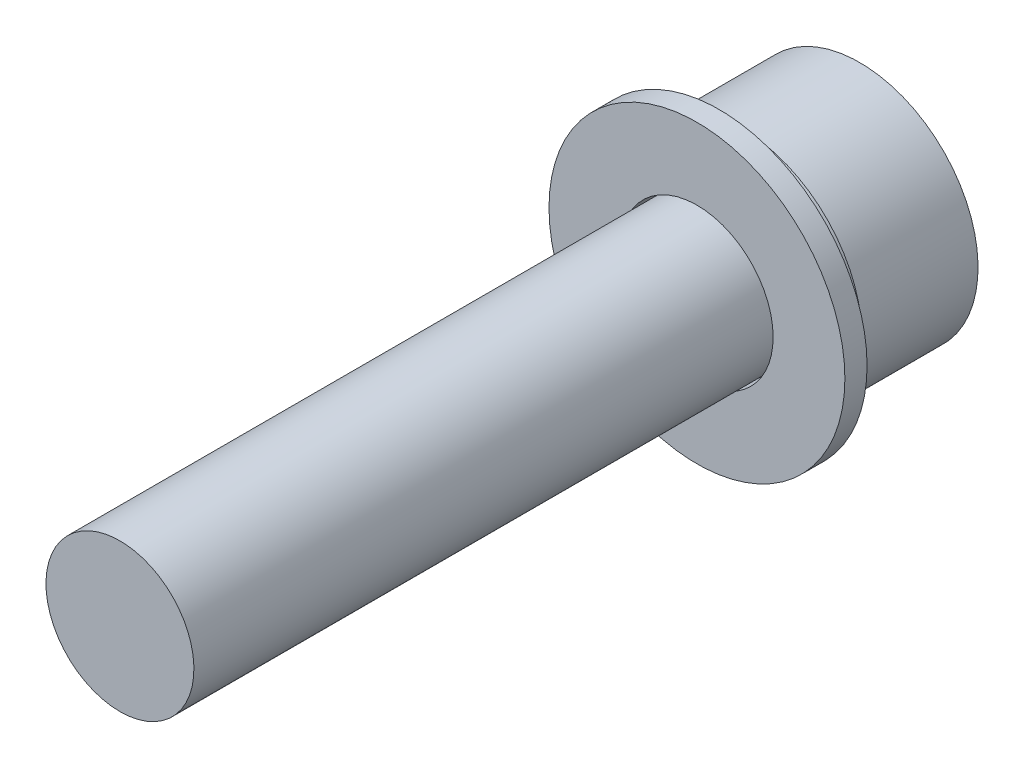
SolidWorks part; units mm, degrees
ref_plane "Front Plane" through (0, 0, 0) normal (0, 0, 1) x (1, 0, 0)
ref_plane "Top Plane" through (0, 0, 0) normal (0, 1, 0) x (1, 0, 0)
ref_plane "Right Plane" through (0, 0, 0) normal (1, 0, 0) x (0, 0, -1)
sketch "Sketch1" plane through (0, 0, 0) normal (1, 0, 0) x (0, 0, -1)
  line L0 (-25, 0) -> (25, 0)
  line L1 (25, 0) -> (25, 8)
  line L2 (25, 8) -> (17, 8)
  line L3 (17, 8) -> (17, 5)
  line L4 (17, 5) -> (-25, 5)
  line L5 (-25, 5) -> (-25, 0)
  point P4 (0, 0)
  dimension "D1" = 50
  dimension "D2" = 8
  dimension "D3" = 5
  dimension "D4" = 8
revolve "Revolve1" add sketch "Sketch1" angle 360 about L0
sketch "Sketch2" plane through (0, 0, -25) normal (0, 0, -1) x (-1, 0, 0)
  line L0 (0, 0) -> (0, 5) construction
  line L1 (0, 0) -> (4.3301, 2.5) construction
  line L2 (0, 0) -> (4.3301, -2.5) construction
  line L3 (0, 0) -> (0, -5) construction
  line L4 (0, 0) -> (-4.3301, -2.5) construction
  line L5 (0, 0) -> (-4.3301, 2.5) construction
  line L6 (0, 5) -> (4.3301, 2.5)
  line L7 (4.3301, 2.5) -> (4.3301, -2.5)
  line L8 (4.3301, -2.5) -> (0, -5)
  line L9 (0, -5) -> (-4.3301, -2.5)
  line L10 (-4.3301, -2.5) -> (-4.3301, 2.5)
  line L11 (-4.3301, 2.5) -> (0, 5)
  circle A0 centre (0, 0) radius 5 construction
  point P11 (0, 0)
  dimension "D1" = 10
  dimension "D2" = 6
extrude "Cut-Extrude1" cut sketch "Sketch2" against normal blind 3
ref_plane "Plane1" through (0, 0, -17) normal (0, 0, 1) x (1, 0, 0)
sketch "Sketch3" plane through (0, 0, -17) normal (0, 0, 1) x (1, 0, 0)
  line L0 (3.1436, -4.0793) -> (4.9748, -6.4555)
  line L1 (2.7033, -4.3835) -> (4.278, -6.9369)
  arc A0 (4.9748, -6.4555) -> (4.278, -6.9369) centre (0, 0) ccw
  arc A1 (3.1436, -4.0793) -> (2.7033, -4.3835) centre (0, 0) ccw
  dimension "D1" = 16.3
  dimension "D2" = 10.3
extrude "Boss-Extrude1" add sketch "Sketch3" along normal blind 1.5 separate body
ref_plane "Plane2" through (0, 0, -15.5) normal (0, 0, 1) x (1, 0, 0)
sketch "Sketch4" plane through (0, 0, -15.5) normal (0, 0, 1) x (1, 0, 0)
  circle A0 centre (0, 0) radius 5.15
  circle A1 centre (0, 0) radius 10
  dimension "D1" = 20
  dimension "D2" = 10.3
extrude "Boss-Extrude2" add sketch "Sketch4" along normal blind 1.5
